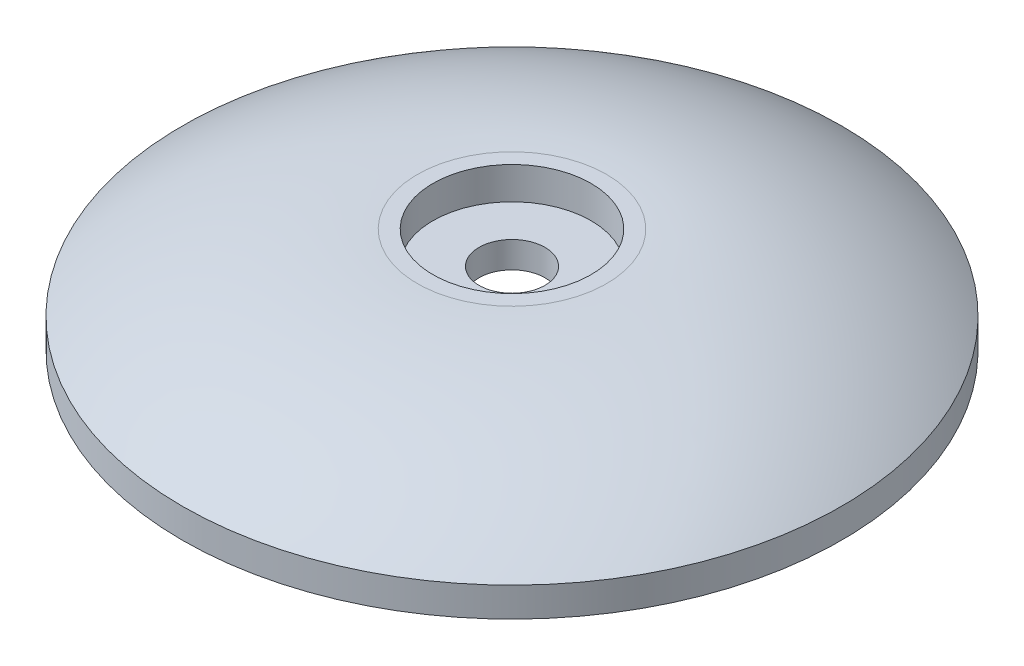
SolidWorks part; units mm, degrees
ref_plane "前视基准面" through (0, 0, 0) normal (0, 0, 1) x (1, 0, 0)
ref_plane "上视基准面" through (0, 0, 0) normal (0, 1, 0) x (1, 0, 0)
ref_plane "右视基准面" through (0, 0, 0) normal (1, 0, 0) x (0, 0, -1)
sketch "草图1" plane through (0, 0, 0) normal (0, 0, 1) x (1, 0, 0)
  line L0 (0, 0) -> (0, 25.2545)
  line L1 (10.1, -1.3516) -> (10.1, 2.1484)
  line L2 (10.1, 2.1484) -> (6, 2.1484)
  line L3 (6, 4.1484) -> (6, 6.5998)
  line L4 (6, 6.5998) -> (7.1784, 6.5998)
  line L5 (25, 0.8824) -> (25, -1.3516)
  line L6 (25, -1.3516) -> (10.1, -1.3516)
  line L7 (6, 2.1484) -> (2.5, 2.1484)
  line L8 (2.5, 2.1484) -> (2.5, 4.1484)
  line L9 (2.5, 4.1484) -> (6, 4.1484)
  arc A0 (7.1784, 6.5998) -> (25, 0.8824) centre (7.8347, -21.989) cw
  dimension "D1" = 10.1
  dimension "D2" = 3.5
  dimension "D3" = 6
  dimension "D4" = 25
  dimension "D5" = 2
  dimension "D6" = 2.5
revolve "旋转1" add sketch "草图1" angle 360 about L0
